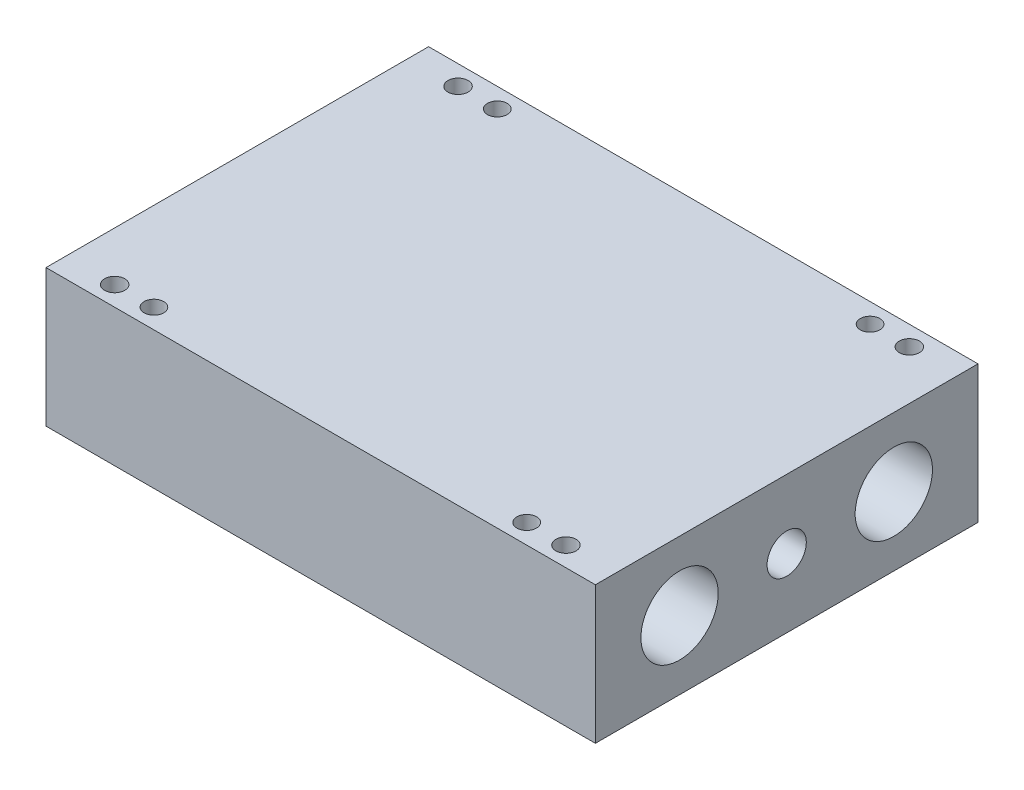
SolidWorks part; units mm, degrees
ref_plane "Front Plane" through (0, 0, 0) normal (0, 0, 1) x (1, 0, 0)
ref_plane "Top Plane" through (0, 0, 0) normal (0, 1, 0) x (1, 0, 0)
ref_plane "Right Plane" through (0, 0, 0) normal (1, 0, 0) x (0, 0, -1)
sketch "Sketch1" plane through (0, 0, 0) normal (1, 0, 0) x (0, 0, -1)
  line L0 (-61.9125, 22.225) -> (-61.9125, -22.225)
  line L1 (-61.9125, -22.225) -> (61.9125, -22.225)
  line L2 (61.9125, -22.225) -> (61.9125, 22.225)
  line L3 (61.9125, 22.225) -> (-61.9125, 22.225)
  line L4 (-61.9125, 22.225) -> (61.9125, -22.225) construction
  dimension "D1" = 123.825
  dimension "D2" = 44.45
extrude "Extrude1" add sketch "Sketch1" along normal mid plane 177.8
hole_wizard "5/16-18 Tapped Hole1" positions "Sketch3" profile "Sketch2" tap size "5/16-18" standard "ANSI Inch"
sketch "Sketch3" plane through (0, 22.225, 0) normal (0, 1, 0) x (1, 0, 0)
  line L0 (-73.025, 55.5625) -> (73.025, -55.5625) construction
  point P0 (-73.025, 55.5625)
  point P2 (73.025, 55.5625)
  point P4 (73.025, -55.5625)
  point P6 (-73.025, -55.5625)
  dimension "D1" = 111.125
  dimension "D2" = 146.05
sketch "Sketch2" plane through (-73.025, 22.225, -55.5625) normal (1, 0, 0) x (0, 0, 1)
  line L0 (0, 0) -> (0, 21.7223)
  line L1 (0, 21.7223) -> (3.2639, 19.7612)
  line L2 (3.2639, 19.7612) -> (3.2639, 0)
  line L5 (3.2639, 0) -> (0, 0)
  line L10 (0, 21.7223) -> (-3.2639, 19.7612) construction
  line L11 (0, -6.35) -> (0, 107.95) construction
  dimension "Tap Drill Dia." = 6.5278
  dimension "Tap Drill Depth" = 19.7612
  dimension "Drill Angle" = 118
hole_wizard "Hole1" positions "Sketch5" profile "Sketch4" legacy
sketch "Sketch5" plane through (0, 22.225, 0) normal (0, 1, 0) x (1, 0, 0)
  line L0 (-60.325, 55.5625) -> (60.325, -55.5625) construction
  point P0 (-60.325, 55.5625)
  point P2 (60.325, 55.5625)
  point P4 (60.325, -55.5625)
  point P6 (-60.325, -55.5625)
  dimension "D1" = 120.65
  dimension "D2" = 111.125
sketch "Sketch4" plane through (-60.325, 22.225, -55.5625) normal (1, 0, 0) x (0, 0, 1)
  line L0 (0, 0) -> (0, 44.45)
  line L1 (0, 44.45) -> (3.175, 44.45)
  line L2 (3.175, 44.45) -> (3.175, 0)
  line L3 (3.175, 0) -> (0, 0)
  line L4 (0, 110) -> (0, -10) construction
  dimension "Diameter" = 6.35
  dimension "Depth" = 44.45
sketch "Sketch6" plane through (88.9, 0, 0) normal (1, 0, 0) x (0, 0, -1)
  line L0 (-34.671, 0) -> (34.671, 0) construction
  circle A0 centre (-34.671, 0) radius 12.5095
  circle A1 centre (0, 0) radius 6.35
  circle A2 centre (34.671, 0) radius 12.5095
  dimension "D1" = 25.019
  dimension "D2" = 12.7
  dimension "D3" = 69.342
extrude "Cut-Extrude1" cut sketch "Sketch6" against normal through all
